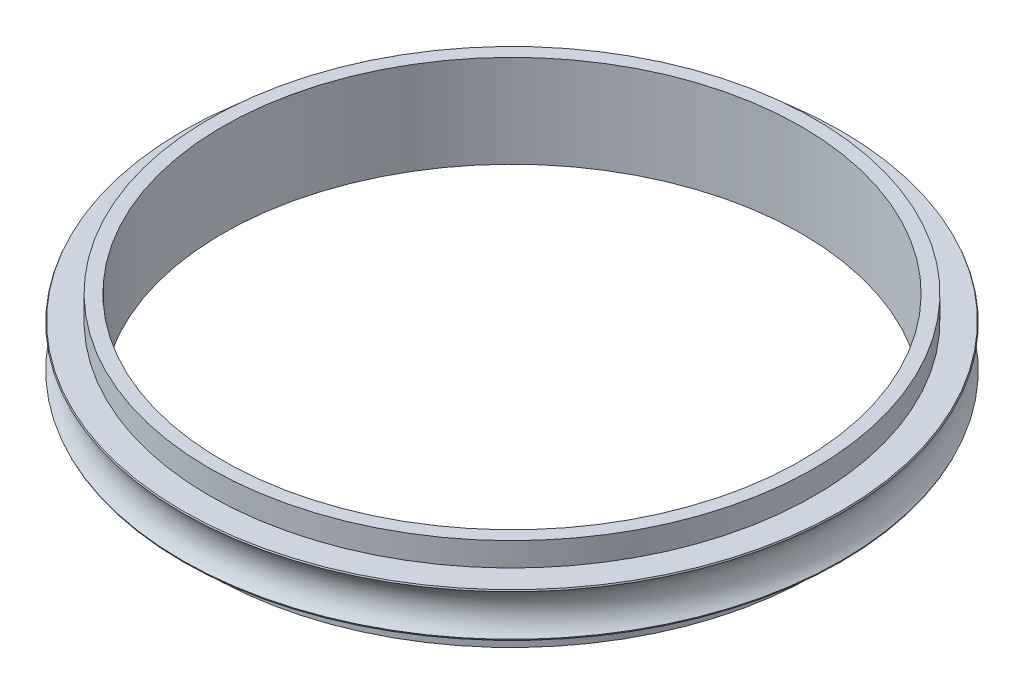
SolidWorks part; units mm, degrees
ref_plane "Plan de face" through (0, 0, 0) normal (0, 0, 1) x (1, 0, 0)
ref_plane "Plan de dessus" through (0, 0, 0) normal (0, 1, 0) x (1, 0, 0)
ref_plane "Plan de droite" through (0, 0, 0) normal (1, 0, 0) x (0, 0, -1)
sketch "Esquisse1" plane through (0, 0, 0) normal (0, 0, 1) x (1, 0, 0)
  line L0 (28.4231, -1.95) -> (28.4934, -1.7788)
  line L1 (28.4934, 1.7788) -> (28.4231, 1.95)
  line L2 (28.4231, 1.95) -> (26, 1.95)
  line L3 (26, 1.95) -> (26, 3.95)
  line L4 (26, 3.95) -> (25, 3.95)
  line L5 (25, 3.95) -> (25, -4.05)
  line L6 (25, -4.05) -> (26, -4.05)
  line L7 (26, -4.05) -> (26, -1.95)
  line L8 (26, -1.95) -> (28.4231, -1.95)
  line L9 (0, 3.95) -> (0, -4.05) construction
  arc A0 (28.4934, -1.7788) -> (28.4934, 1.7788) centre (30.25, 0) cw
revolve "Révolution1" add sketch "Esquisse1" angle 360 about L9
sketch "Esquisse2" plane through (0, 3.95, 0) normal (0, 1, 0) x (1, 0, 0)
  circle A0 centre (0, 0) radius 26.15
  circle A1 centre (0, 0) radius 25
  circle A2 centre (0, 0) radius 25 construction
  dimension "D1" = 52.3
extrude "Boss.-Extru.1" add sketch "Esquisse2" against normal up to surface (8 mm away)
sketch "Esquisse3" plane through (0, 0, 0) normal (0, 0, 1) x (1, 0, 0)
  line L0 (0, 0) -> (0, 16.134) construction
  line L1 (-34.2457, 5.583) -> (-26.15, 5.583)
  line L2 (-34.2457, 5.583) -> (-34.2457, 1.9)
  line L3 (-34.2457, 1.9) -> (-26.15, 1.9)
  line L4 (-26.15, 5.583) -> (-26.15, 1.9)
  line L5 (-34.2457, -1.9) -> (-26.15, -1.9)
  line L6 (-34.2457, -1.9) -> (-34.2457, -6.0613)
  line L7 (-34.2457, -6.0613) -> (-26.15, -6.0613)
  line L8 (-26.15, -1.9) -> (-26.15, -6.0613)
  line L9 (0, 16.134) -> (0, -32.268) construction
  line L10 (-26.15, 3.95) -> (-26.15, 1.95) construction
  line L11 (-26.15, -1.95) -> (-26.15, -4.05) construction
  dimension "D1" = 1.9
  dimension "D2" = 1.9
revolve "Enlèvement de matière-Révolution1" cut sketch "Esquisse3" angle 360 about L0
